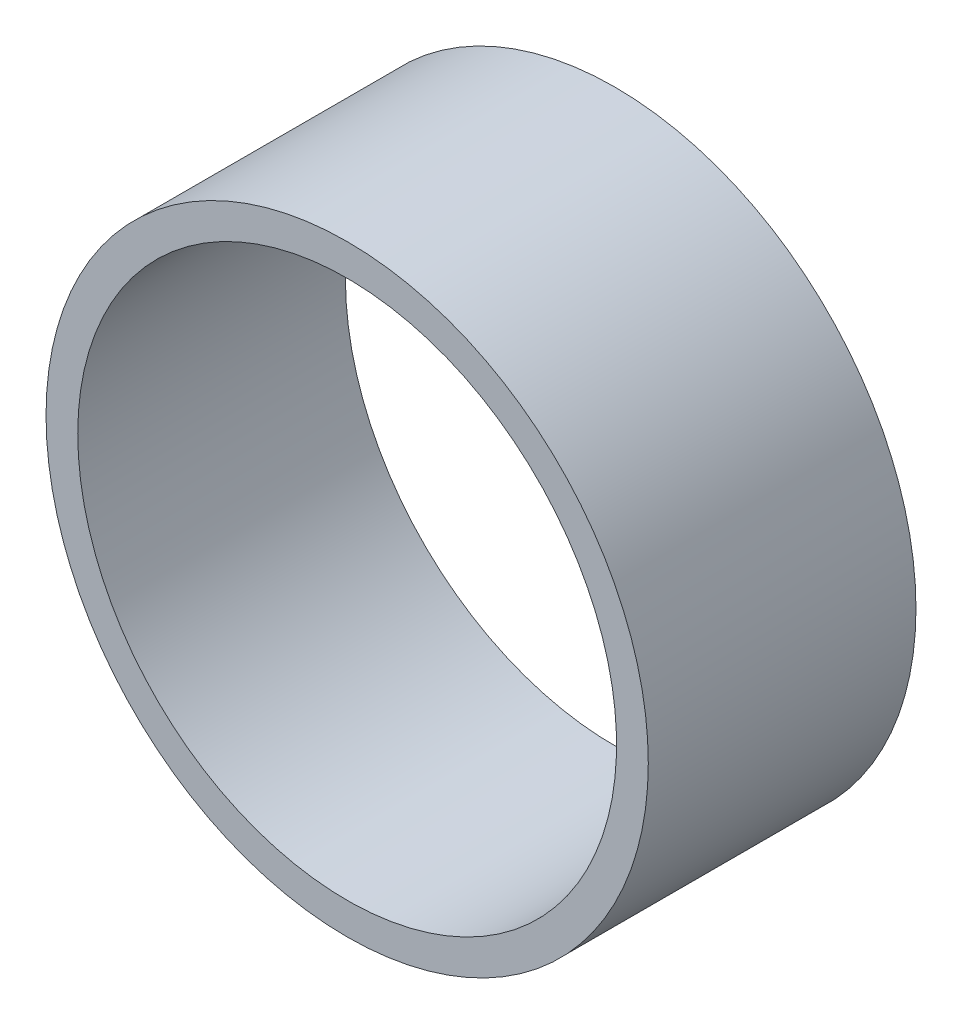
SolidWorks part; units mm, degrees
ref_plane "Front" through (0, 0, 0) normal (0, 0, 1) x (1, 0, 0)
ref_plane "Top" through (0, 0, 0) normal (0, 1, 0) x (1, 0, 0)
ref_plane "Side" through (0, 0, 0) normal (1, 0, 0) x (0, 0, -1)
sketch "PipeSketch"
  dimension "OuterDiameter" = 114.3
  dimension "InnerDiameter" = 102.2604
extrude "Extrusion" add sketch "PipeSketch" along normal blind 50.8
sketch "FilterSketch" plane through (0, 0, 0) normal (0, 0, 1) x (1, 0, 0)
  circle A0 centre (0, 0) radius 50.8 construction
  dimension "NominalDiameter" = 101.6
sketch "Skizze1" plane through (0, 0, 0) normal (0, 0, -1) x (-1, 0, 0)
  circle A0 centre (0, 0) radius 51.1302
  circle A1 centre (0, 0) radius 51.1302 construction
extrude "Schnitt-Linear austragen1" cut sketch "Skizze1" against normal through all
